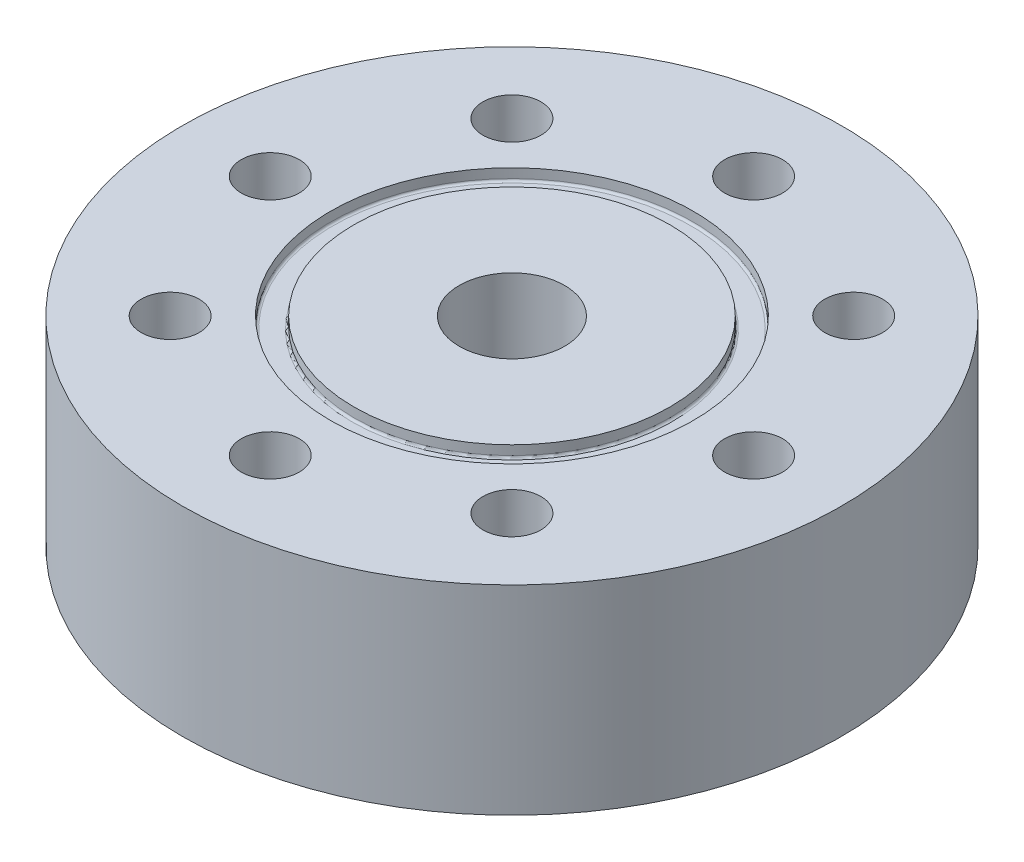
SolidWorks part; units mm, degrees
ref_plane "Front Plane" through (0, 0, 0) normal (0, 0, 1) x (1, 0, 0)
ref_plane "Top Plane" through (0, 0, 0) normal (0, 1, 0) x (1, 0, 0)
ref_plane "Right Plane" through (0, 0, 0) normal (1, 0, 0) x (0, 0, -1)
sketch "Sketch2" plane through (0, 0, 0) normal (0, 1, 0) x (1, 0, 0)
  circle A0 centre (0, 0) radius 37.5
  dimension "D1" = 75
extrude "Outer Cylinder" add sketch "Sketch2" along normal blind 22.7
sketch "Sketch3" plane through (0, 0, 0) normal (0, -1, 0) x (1, 0, 0)
  circle A0 centre (0, 0) radius 8.93
  dimension "D1" = 17.86
extrude "NPT Hole" cut sketch "Sketch3" against normal blind 12.7
sketch "Sketch4" plane through (0, 0, 0) normal (0, -1, 0) x (1, 0, 0)
  circle A0 centre (-27.5, 0) radius 3.3
  circle A1 centre (-19.4454, 19.4454) radius 3.3
  circle A2 centre (0, 27.5) radius 3.3
  circle A3 centre (19.4454, 19.4454) radius 3.3
  circle A4 centre (27.5, 0) radius 3.3
  circle A5 centre (19.4454, -19.4454) radius 3.3
  circle A6 centre (0, -27.5) radius 3.3
  circle A7 centre (-19.4454, -19.4454) radius 3.3
  point P19 (0, 0)
  dimension "D1" = 6.6
  dimension "D2" = 27.5
  dimension "D3" = 8
extrude "Bolt Holes" cut sketch "Sketch4" against normal through all
sketch "Sketch5" plane through (0, 22.7, 0) normal (0, 1, 0) x (1, 0, 0)
  circle A0 centre (0, 0) radius 17.9705
  circle A1 centre (0, 0) radius 20.6375
  dimension "D1" = 41.275
  dimension "D2" = 2.667
extrude "O-Ring Groove" cut sketch "Sketch5" against normal blind 1.3208
fillet "Fillet1" radius 0.254 2 edges at (0, 21.3792, 17.9705) (0, 21.3792, 20.6375)
sketch "Sketch6" plane through (0, 22.7, 0) normal (0, 1, 0) x (1, 0, 0)
  circle A0 centre (0, 0) radius 6
extrude "Inlet Flow Diameter" cut sketch "Sketch6" against normal blind 10
equation "\"D\"= 12"
equation "\"Inlet Flow Diameter\"= \"D\""
equation "\"D1@Sketch6\"=\"D\""
